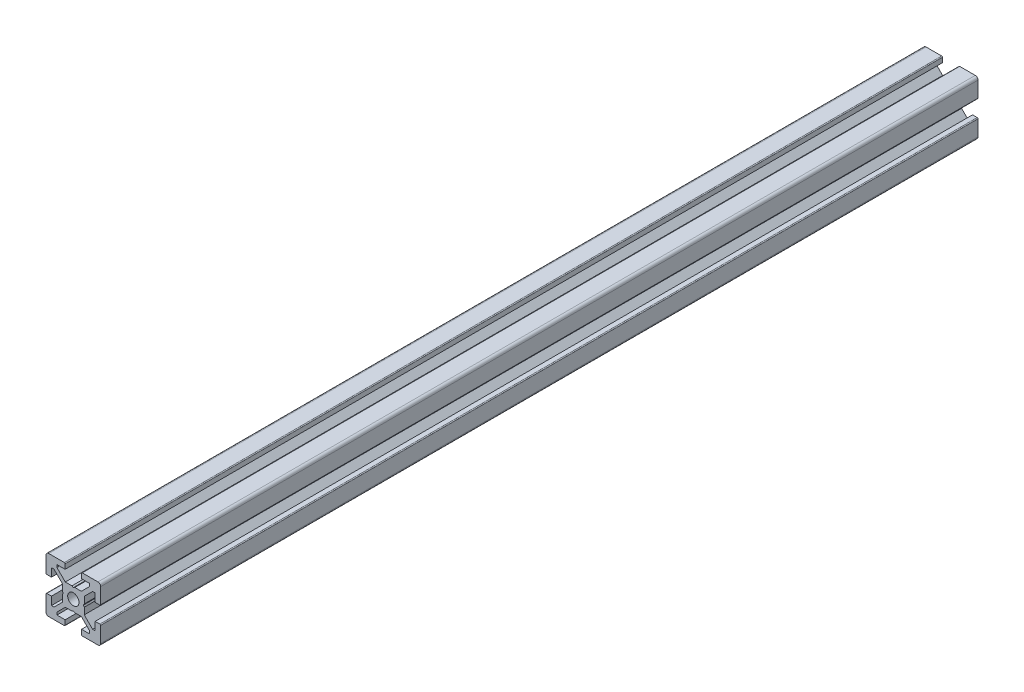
SolidWorks part; units mm, degrees
ref_plane "Front Plane" through (0, 0, 0) normal (0, 0, 1) x (1, 0, 0)
ref_plane "Top Plane" through (0, 0, 0) normal (0, 1, 0) x (1, 0, 0)
ref_plane "Right Plane" through (0, 0, 0) normal (1, 0, 0) x (0, 0, -1)
ref_plane "Plane1" through (0, 0, 0) normal (0, 0, 1) x (1, 0, 0)
sketch "Sketch1" plane through (0, 0, 0) normal (0, 0, 1) x (1, 0, 0)
  line L0 (-10, 9) -> (-10, 3.3)
  line L1 (-9.7, 3) -> (-8, 3)
  line L2 (-8, 3) -> (-8, 6)
  line L3 (-8, 6) -> (-7.0607, 6)
  line L4 (-7.0607, 6) -> (-4, 2.9393)
  line L5 (-4, 2.9393) -> (-4, 0.5196)
  line L6 (-4, 0.5196) -> (-3.7, 0)
  line L7 (-3.7, 0) -> (-4, -0.5196)
  line L8 (-4, -0.5196) -> (-4, -2.9393)
  line L9 (-4, -2.9393) -> (-7.0607, -6)
  line L10 (-7.0607, -6) -> (-8, -6)
  line L11 (-8, -6) -> (-8, -3)
  line L12 (-8, -3) -> (-9.7, -3)
  line L13 (-10, -3.3) -> (-10, -9)
  line L14 (-9, -10) -> (-3.3, -10)
  line L15 (-3, -9.7) -> (-3, -8)
  line L16 (-3, -8) -> (-6, -8)
  line L17 (-6, -8) -> (-6, -7.0607)
  line L18 (-6, -7.0607) -> (-2.9393, -4)
  line L19 (-2.9393, -4) -> (-0.5196, -4)
  line L20 (-0.5196, -4) -> (0, -3.7)
  line L21 (0, -3.7) -> (0.5196, -4)
  line L22 (0.5196, -4) -> (2.9393, -4)
  line L23 (2.9393, -4) -> (6, -7.0607)
  line L24 (6, -7.0607) -> (6, -8)
  line L25 (6, -8) -> (3, -8)
  line L26 (3, -8) -> (3, -9.7)
  line L27 (3.3, -10) -> (9, -10)
  line L28 (10, -9) -> (10, -3.3)
  line L29 (9.7, -3) -> (8, -3)
  line L30 (8, -3) -> (8, -6)
  line L31 (8, -6) -> (7.0606, -6)
  line L32 (7.0606, -6) -> (4, -2.9393)
  line L33 (4, -2.9393) -> (4, -0.5196)
  line L34 (4, -0.5196) -> (3.7, 0)
  line L35 (3.7, 0) -> (4, 0.5196)
  line L36 (4, 0.5196) -> (4, 2.9393)
  line L37 (4, 2.9393) -> (7.0607, 6)
  line L38 (7.0607, 6) -> (8, 6)
  line L39 (8, 6) -> (8, 3)
  line L40 (8, 3) -> (9.7, 3)
  line L41 (10, 3.3) -> (10, 9)
  line L42 (9, 10) -> (3.3, 10)
  line L43 (3, 9.7) -> (3, 8)
  line L44 (3, 8) -> (6, 8)
  line L45 (6, 8) -> (6, 7.0607)
  line L46 (6, 7.0607) -> (2.9393, 4)
  line L47 (2.9393, 4) -> (0.5196, 4)
  line L48 (0.5196, 4) -> (0, 3.7)
  line L49 (0, 3.7) -> (-0.5196, 4)
  line L50 (-0.5196, 4) -> (-2.9394, 4)
  line L51 (-2.9394, 4) -> (-6, 7.0606)
  line L52 (-6, 7.0606) -> (-6, 8)
  line L53 (-6, 8) -> (-3, 8)
  line L54 (-3, 8) -> (-3, 9.7)
  line L55 (-3.3, 10) -> (-9, 10)
  arc A0 (-10, 3.3) -> (-9.7, 3) centre (-9.7, 3.3) ccw
  arc A1 (-9.7, -3) -> (-10, -3.3) centre (-9.7, -3.3) ccw
  arc A2 (-10, -9) -> (-9, -10) centre (-9, -9) ccw
  arc A3 (-3.3, -10) -> (-3, -9.7) centre (-3.3, -9.7) ccw
  arc A4 (3, -9.7) -> (3.3, -10) centre (3.3, -9.7) ccw
  arc A5 (9, -10) -> (10, -9) centre (9, -9) ccw
  arc A6 (10, -3.3) -> (9.7, -3) centre (9.7, -3.3) ccw
  arc A7 (9.7, 3) -> (10, 3.3) centre (9.7, 3.3) ccw
  arc A8 (10, 9) -> (9, 10) centre (9, 9) ccw
  arc A9 (3.3, 10) -> (3, 9.7) centre (3.3, 9.7) ccw
  arc A10 (-3, 9.7) -> (-3.3, 10) centre (-3.3, 9.7) ccw
  arc A11 (-9, 10) -> (-10, 9) centre (-9, 9) ccw
extrude "Boss-Extrude1" add sketch "Sketch1" against normal blind 321
ref_plane "Plane2" through (0, 0, 0) normal (1, 0, 0) x (0, 0, -1)
sketch "Sketch2" plane through (0, 0, 0) normal (1, 0, 0) x (0, 0, -1)
  line L0 (0, 0) -> (0, 2.067)
  line L1 (55, 0) -> (-55, 0) construction
  line L2 (0, 2.067) -> (321, 2.067)
  line L3 (321, 2.067) -> (321, 0)
  line L4 (321, 0) -> (0, 0)
  line L5 (321, 0) -> (0, 0) construction
  line L6 (321, -0.5196) -> (321, 0) construction
  dimension "D1" = 2.067
revolve "Cut-Revolve1" cut sketch "Sketch2" angle 360 about L5
ref_plane "Plane3" through (0, 0, 0) normal (1, 0, 0) x (0, 0, -1)
sketch "Sketch3" plane through (0, 0, 0) normal (1, 0, 0) x (0, 0, -1)
  line L0 (11, 0) -> (-11, 0) construction
  line L1 (321, 0.5196) -> (321, 2.9393) construction
  line L2 (0, 11) -> (0, -11) construction
  circle A0 centre (10, 0) radius 3
  circle A1 centre (311, 0) radius 3
  dimension "D2" = 10
  dimension "D3" = 6
  dimension "D1" = 10
extrude "Cut-Extrude1" [suppressed] cut sketch "Sketch3" against normal through all both and the other way through all
